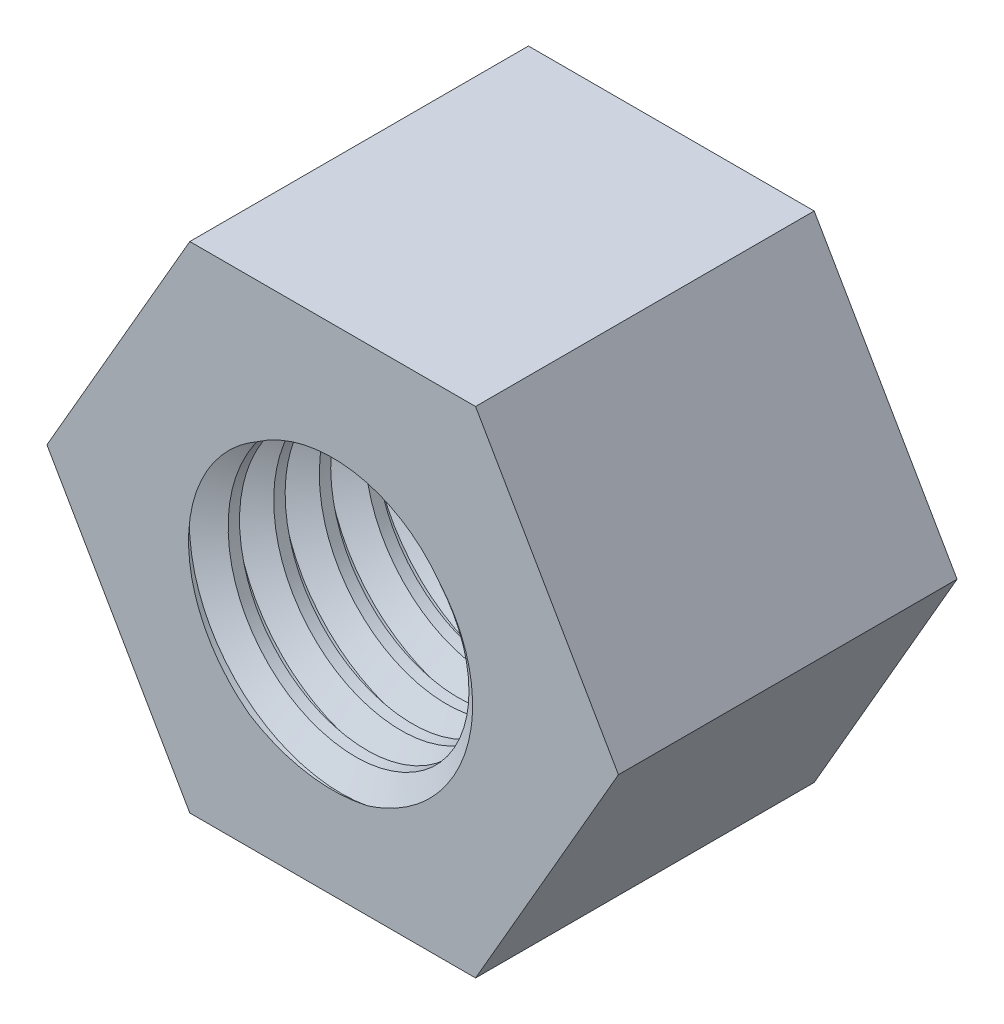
SolidWorks part; units mm, degrees
ref_plane "Ebene vorne" through (0, 0, 0) normal (0, 0, 1) x (1, 0, 0)
ref_plane "Ebene oben" through (0, 0, 0) normal (0, 1, 0) x (1, 0, 0)
ref_plane "Ebene rechts" through (0, 0, 0) normal (1, 0, 0) x (0, 0, -1)
sketch "Skizze1" plane through (0, 0, 0) normal (0, 0, 1) x (1, 0, 0)
  line L1 (10.9697, 0) -> (5.4848, 9.5)
  line L2 (5.4848, 9.5) -> (-5.4848, 9.5)
  line L3 (-5.4848, 9.5) -> (-10.9697, 0)
  line L4 (-10.9697, 0) -> (-5.4848, -9.5)
  line L5 (-5.4848, -9.5) -> (5.4848, -9.5)
  line L6 (5.4848, -9.5) -> (10.9697, 0)
  circle A0 centre (0, 0) radius 9.5 construction
  dimension "D1" = 19
extrude "Aufsatz-Linear austragen1" add sketch "Skizze1" along normal blind 13
sketch "Skizze5" plane through (0, 0, 13) normal (0, 0, 1) x (1, 0, 0)
  circle A0 centre (0, 0) radius 6
  dimension "D1" = 12
extrude "Schnitt-Linear austragen1" cut sketch "Skizze5" against normal through all contours A0
thread "Gewinde2" pitch 1.75 start angle 0, offset 3, length 53, pitch 1.75, diameter 12
ref_plane "Ebene2" through (-6, 0, 16) normal (0, -1, 0) x (-1, 0, 0)
sketch "Gewindeprofil2" plane through (-6, 0, 16) normal (0, -1, 0) x (-1, 0, 0)
  line L0 (0, 0) -> (0, 1.75) construction
  line L11 (0, 0) -> (0, 1.5312)
  line L12 (0, 1.5312) -> (-0.9472, 0.9844)
  line L13 (-0.9472, 0.9844) -> (-0.9472, 0.5469)
  line L15 (-0.9472, 0.5469) -> (0, 0)
  line L17 (-0.9472, 0.7656) -> (0, 0.7656) construction
  point P2 (0, 0)
  dimension "Pitch" = 1.75
  dimension "Profile_Angle" = 60
  dimension "Profile_Land" = 0.4375
  dimension "Profile_Height" = 0.9472
